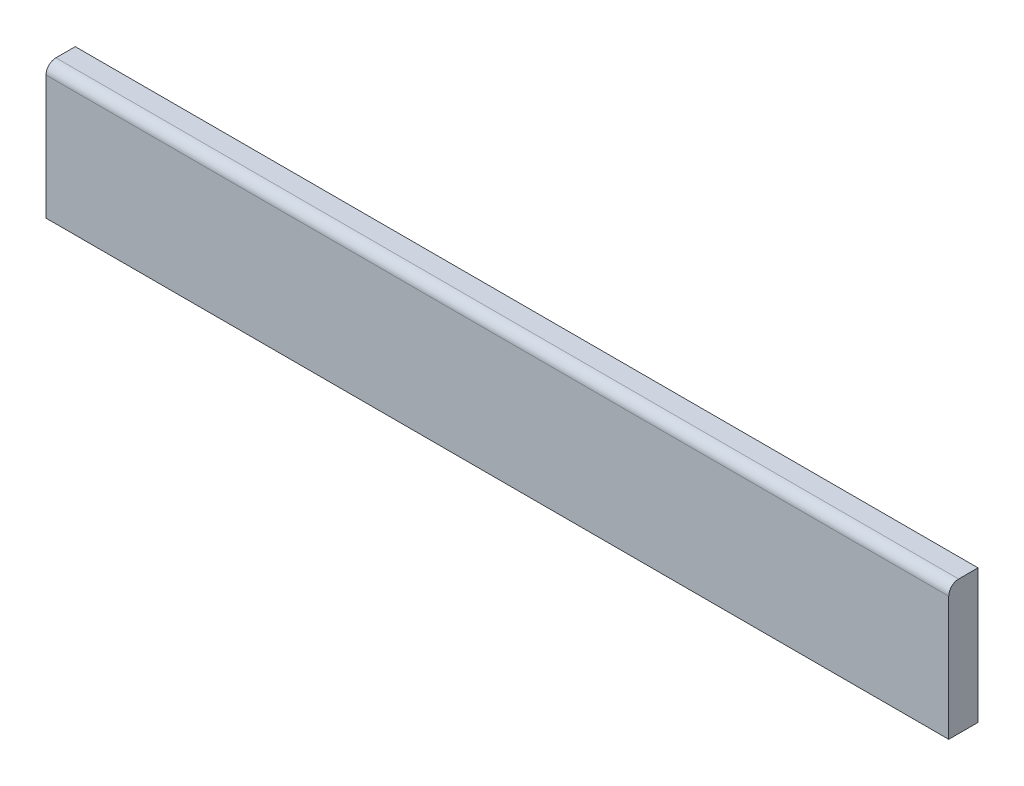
SolidWorks part; units mm, degrees
ref_plane "Спереди" through (0, 0, 0) normal (0, 0, 1) x (1, 0, 0)
ref_plane "Сверху" through (0, 0, 0) normal (0, 1, 0) x (1, 0, 0)
ref_plane "Справа" through (0, 0, 0) normal (1, 0, 0) x (0, 0, -1)
sketch "Эскиз1" plane through (0, 0, 0) normal (0, 0, 1) x (1, 0, 0)
  line L0 (-855, 0) -> (-490, 0) construction
  line L1 (-949, 93) -> (949, 93)
  line L2 (-949, 93) -> (-949, -157)
  line L3 (-949, -157) -> (949, -157)
  line L4 (949, 93) -> (949, -157)
  line L5 (0, -157) -> (0, 93) construction
  line L6 (-793, -142) -> (-428, -142) construction
  line L7 (-428, -142) -> (-63, -142) construction
  line L9 (-490, 0) -> (-125, 0) construction
  circle A0 centre (-490, 0) radius 5
  circle A1 centre (-855, 0) radius 5
  circle A2 centre (-125, 0) radius 5
  circle A5 centre (-872.6, -137) radius 5
  circle A6 centre (-872.6, -57) radius 5
  circle A7 centre (125, 0) radius 5
  circle A8 centre (-793, -142) radius 5
  circle A9 centre (872.6, -137) radius 5
  circle A10 centre (872.6, -57) radius 5
  circle A11 centre (-428, -142) radius 5
  circle A12 centre (-63, -142) radius 5
  circle A13 centre (490, 0) radius 5
  circle A14 centre (855, 0) radius 5
  circle A15 centre (63, -142) radius 5
  circle A16 centre (428, -142) radius 5
  circle A17 centre (793, -142) radius 5
  dimension "D3" = 10
  dimension "D8" = 94
  dimension "D9" = 20
  dimension "D10" = 80
  dimension "D12" = 76.4
  dimension "D13" = 156
  dimension "D1" = 250
  dimension "D2" = 1898
  dimension "D4" = 365
  dimension "D5" = 157
  dimension "D6" = 365
  dimension "D11" = 76.4
  dimension "D14" = 15
extrude "Бобышка-Вытянуть1" add sketch "Эскиз1" along normal blind 16
sketch "Эскиз3" plane through (0, 0, 16) normal (0, 0, 1) x (1, 0, 0)
  line L0 (0, 0) -> (0, -41) construction
  line L1 (-27, -41) -> (27, -41) construction
  line L2 (-27, -41) -> (-27, -77) construction
  line L3 (-27, -77) -> (27, -77) construction
  line L4 (27, -41) -> (27, -77) construction
  line L5 (-949, -157) -> (949, -157) construction
  circle A0 centre (-27, -77) radius 5
  circle A1 centre (-27, -41) radius 5
  circle A2 centre (27, -41) radius 5
  circle A3 centre (27, -77) radius 5
  dimension "D4" = 10
  dimension "D1" = 36
  dimension "D2" = 54
  dimension "D3" = 80
extrude "Вырез-Вытянуть2" cut sketch "Эскиз3" against normal through all
other "Переместить грань1" parameters "D1"=20
sketch "Эскиз4" plane through (0, 0, 16) normal (0, 0, 1) x (1, 0, 0)
  line L4 (-969, 113) -> (-969, -157)
  line L5 (-969, -157) -> (969, -157)
  line L6 (969, -157) -> (969, 113)
  line L7 (969, 113) -> (-969, 113)
  line L8 (-969, 113) -> (-969, -157)
  line L9 (-969, -157) -> (969, -157)
  line L10 (969, -157) -> (969, 113)
  line L11 (969, 113) -> (-969, 113)
  dimension "D1" = 0
extrude "Бобышка-Вытянуть2" add sketch "Эскиз4" along normal blind 43
fillet "Скругление1" radius 20 5 edges at (0, 113, 59) (-969, -22, 59) (969, -22, 59) (-969, 113, 29.5) (969, 113, 29.5)
sketch "Эскиз5" plane through (0, 113, 0) normal (0, 1, 0) x (1, 0, 0)
  line L0 (969, 0) -> (949, 0) construction
  line L1 (969, 0) -> (910, 0)
  line L2 (969, 0) -> (969, -59)
  line L3 (969, -59) -> (910, -59)
  line L4 (910, 0) -> (910, -59)
  line L5 (969, 0) -> (969, -39) construction
  line L6 (949, -59) -> (-949, -59) construction
  line L7 (0, -59) -> (0, -171.9523) construction
  line L8 (-910, 0) -> (-910, -59)
  line L9 (-969, -59) -> (-910, -59)
  line L10 (-969, 0) -> (-969, -59)
  line L11 (-969, 0) -> (-910, 0)
  dimension "D1" = 59
extrude "Вырез-Вытянуть3" cut sketch "Эскиз5" against normal through all
